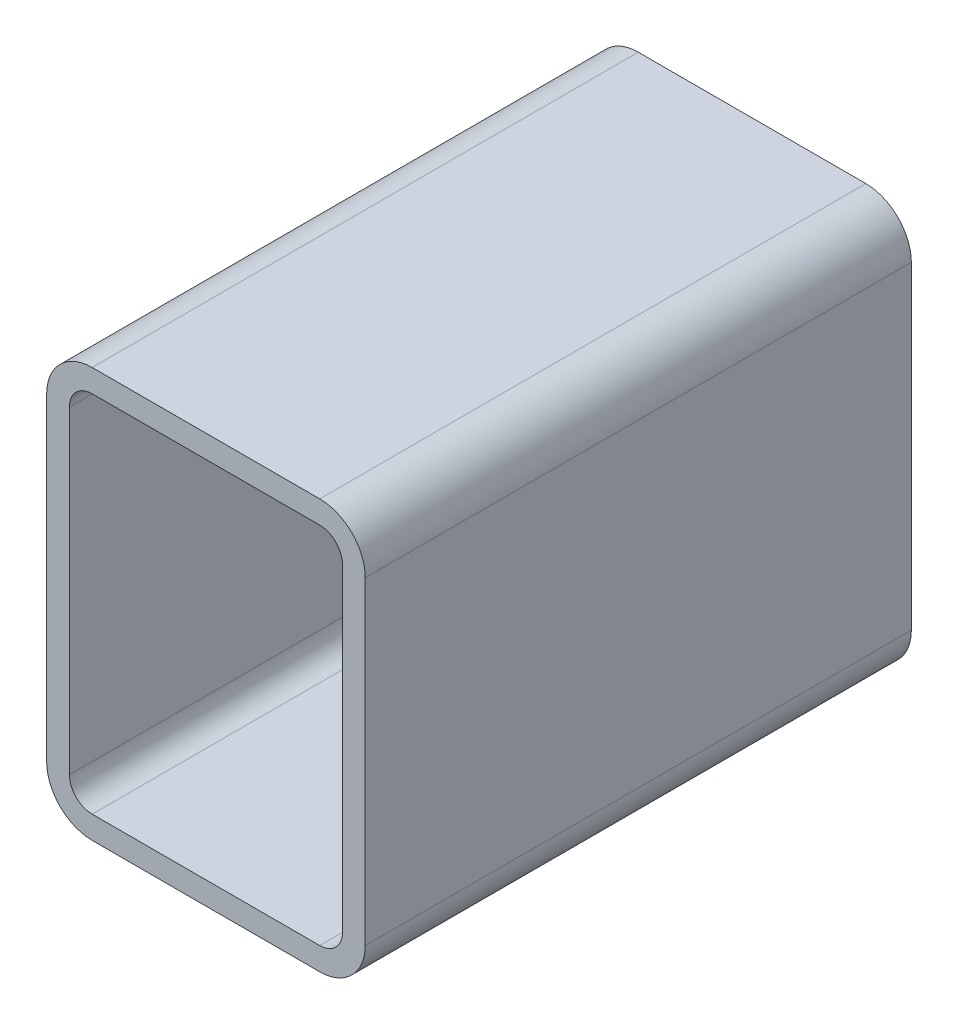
SolidWorks part; units mm, degrees
ref_plane "Front Plane" through (0, 0, 0) normal (0, 0, 1) x (1, 0, 0)
ref_plane "Top Plane" through (0, 0, 0) normal (0, 1, 0) x (1, 0, 0)
ref_plane "Right Plane" through (0, 0, 0) normal (1, 0, 0) x (0, 0, -1)
sketch "Sketch1" plane through (0, 0, 0) normal (0, 0, 1) x (1, 0, 0)
  point P0 (0, 0)
sketch_block_instance "HSS9x7x0.500-1"
sketch_block "HSS9x7x0.500"
extrude "Boss-Extrude1" add sketch "Sketch1" along normal blind 304.8
